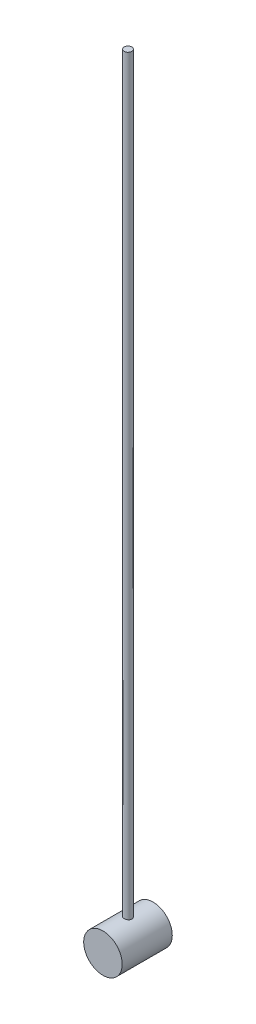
SolidWorks part; units mm, degrees
ref_plane "Plan de face" through (0, 0, 0) normal (0, 0, 1) x (1, 0, 0)
ref_plane "Plan de dessus" through (0, 0, 0) normal (0, 1, 0) x (1, 0, 0)
ref_plane "Plan de droite" through (0, 0, 0) normal (1, 0, 0) x (0, 0, -1)
sketch "Esquisse1" plane through (0, 0, 0) normal (0, 0, 1) x (1, 0, 0)
  circle A0 centre (0, 0) radius 2.5
  dimension "D1" = 5
extrude "Boss.-Extru.1" add sketch "Esquisse1" along normal mid plane 6.5
sketch "Esquisse2" plane through (0, 0, 0) normal (0, 1, 0) x (1, 0, 0)
  circle A0 centre (0, 0) radius 0.5
  dimension "D1" = 1
extrude "Boss.-Extru.2" add sketch "Esquisse2" along normal blind 100
